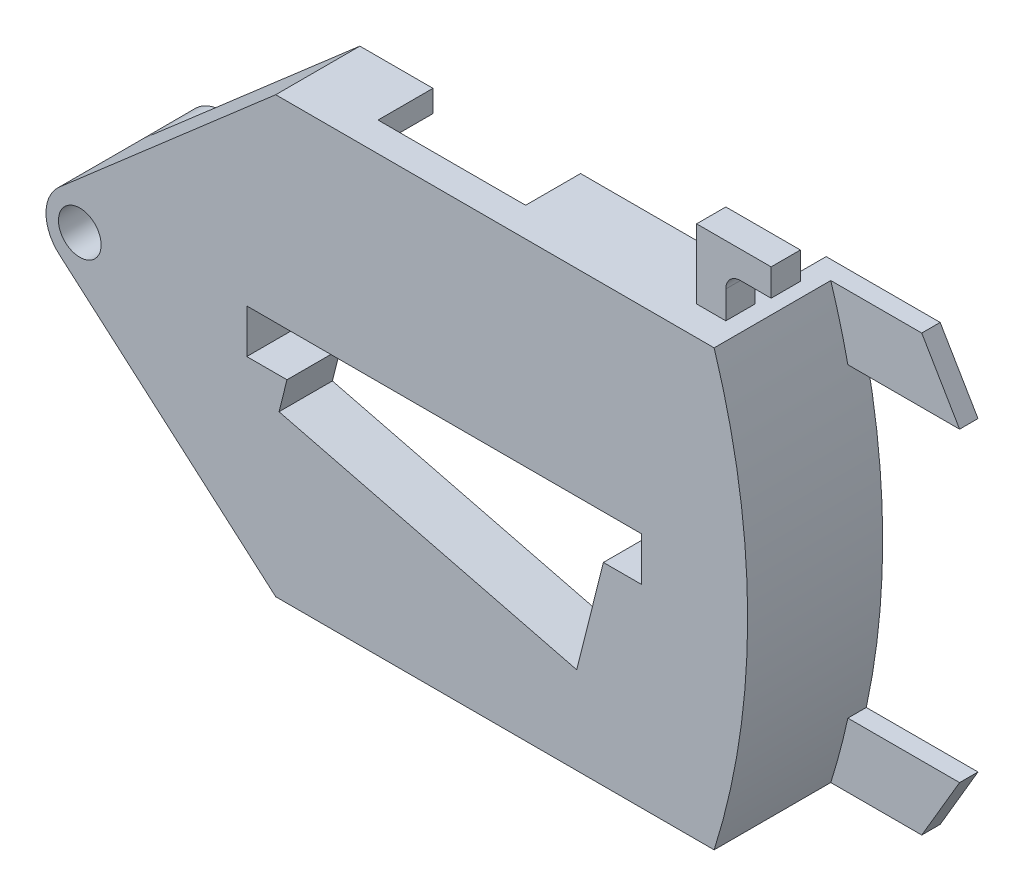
SolidWorks part; units mm, degrees
ref_plane "Plane1" through (0, 0, 0) normal (0, 0, 1) x (1, 0, 0)
ref_plane "Plane2" through (0, 0, 0) normal (0, 1, 0) x (1, 0, 0)
ref_plane "Plane3" through (0, 0, 0) normal (1, 0, 0) x (0, 0, -1)
sketch "Sketch1" plane through (0, 0, 0) normal (0, 0, 1) x (1, 0, 0)
  line L0 (-12.6668, 0) -> (55.8663, 0) construction
  line L1 (0, 0) -> (17.1073, 14.875)
  line L2 (0, 0) -> (17.1073, -14.875)
  line L3 (17.1073, 14.875) -> (47.1073, 14.875)
  line L4 (17.1073, -14.875) -> (47.1073, -14.875)
  arc A0 (47.1073, -14.875) -> (47.1073, 14.875) centre (0, 0) ccw
  dimension "D2" = 49.4
  dimension "D1" = 29.75
  dimension "D3" = 30
extrude "Base-Extrude" add sketch "Sketch1" along normal blind 5.76
sketch "Sketch2" plane through (0, 0, 5.76) normal (0, 0, 1) x (1, 0, 0)
  line L2 (0, 0) -> (17.1073, 14.875) construction
  line L3 (0, 0) -> (17.1073, -14.875) construction
  circle A0 centre (4.0387, 0) radius 2.65
  dimension "D1" = 5.3
extrude "Boss-Extrude1" add sketch "Sketch2" against normal blind 9.45
sketch "Sketch3" plane through (0, 0, 5.76) normal (0, 0, 1) x (1, 0, 0)
  line L0 (0, 0) -> (17.1073, -14.875) construction
  line L1 (0, 0) -> (17.1073, 14.875) construction
  line L2 (0, 0) -> (2.2999, -1.9998)
  line L3 (0, 0) -> (2.2999, 1.9998)
  arc A0 (2.2999, 1.9998) -> (2.2999, -1.9998) centre (4.0387, 0) ccw construction
  arc A1 (2.2999, 1.9998) -> (2.2999, -1.9998) centre (4.0387, 0) ccw
extrude "Cut-Extrude3" cut sketch "Sketch3" against normal through all
sketch "Sketch4" plane through (0, 0, -3.69) normal (0, 0, -1) x (-1, 0, 0)
  circle A0 centre (-4.0387, 0) radius 1.37
  dimension "D1" = 2.74
extrude "Boss-Extrude2" add sketch "Sketch4" along normal blind 2.64 draft 1
sketch "Sketch6" plane through (0, 0, 5.76) normal (0, 0, 1) x (1, 0, 0)
  line L0 (1.3887, 0) -> (49.4, 0) construction
  line L1 (1.3887, 0) -> (1.3887, 1.0249) construction
  arc A1 (47.1073, -14.875) -> (47.1073, 14.875) centre (0, 0) ccw construction
  arc A2 (2.2999, 1.9998) -> (2.2999, -1.9998) centre (4.0387, 0) ccw construction
  dimension "D1" = 48.0113
sketch "Sketch7" plane through (0, 0, 5.76) normal (0, 0, 1) x (1, 0, 0)
  circle A2 centre (3.7016, 0) radius 1.15
  dimension "D1" = 2.3
extrude "Cut-Extrude4" cut sketch "Sketch7" against normal offset from surface (11.09 mm away) 1
sketch "Sketch8" plane through (0, 0, 5.76) normal (0, 0, 1) x (1, 0, 0)
  line L0 (-0.719, 1.37) -> (50.999, 1.37) construction
  line L1 (15.1282, 1.37) -> (42.1282, 1.37)
  line L2 (42.1282, 1.37) -> (42.1282, -1.63)
  line L3 (42.1282, -1.63) -> (39.5282, -1.63)
  line L4 (39.5282, -1.63) -> (37.7042, -8.9048)
  line L5 (37.7042, -8.9048) -> (17.3347, -3.7977)
  line L6 (17.3347, -3.7977) -> (17.8782, -1.63)
  line L7 (17.8782, -1.63) -> (15.1282, -1.63)
  line L8 (15.1282, -1.63) -> (15.1282, 1.37)
  circle A0 centre (4.0387, 0) radius 1.37 construction
  dimension "D1" = 27
  dimension "D2" = 21
  dimension "D3" = 3
  dimension "D4" = 3
  dimension "D5" = 7.5
  dimension "D6" = 2.6
  dimension "D7" = 2.75
  dimension "D8" = 2.2348
extrude "Cut-Extrude5" cut sketch "Sketch8" against normal through all
sketch "Sketch9" plane through (0, 0, 0) normal (0, 0, -1) x (-1, 0, 0)
  line L12 (-3.2841, 0.8678) -> (-17.6682, 13.375)
  line L13 (-17.6682, 13.375) -> (-45.9948, 13.375)
  line L14 (-17.6682, -13.375) -> (-45.9948, -13.375)
  line L15 (-3.2841, -0.8678) -> (-17.6682, -13.375)
  line L16 (-5.0857, 2.4344) -> (-17.6682, 13.375)
  line L17 (-17.6682, 13.375) -> (-45.9948, 13.375)
  line L18 (-17.6682, -13.375) -> (-45.9948, -13.375)
  line L19 (-5.0857, -2.4344) -> (-17.6682, -13.375)
  circle A4 centre (-4.0387, 0) radius 2.65 construction
  arc A5 (-45.9948, 13.375) -> (-45.9948, -13.375) centre (0, 0) ccw
  arc A6 (-45.9948, 13.375) -> (-45.9948, -13.375) centre (0, 0) ccw
  arc A7 (-5.0857, 2.4344) -> (-5.0857, -2.4344) centre (-4.0387, 0) ccw
  dimension "D1" = 1.5
extrude "Cut-Extrude6" cut sketch "Sketch9" against normal offset from surface (3.76 mm away) 2
sketch "Sketch10" plane through (0, 0, 3.76) normal (0, 0, -1) x (-1, 0, 0)
  line L0 (-15.1282, 1.37) -> (-15.1282, -1.63) construction
  line L1 (-15.1282, -1.63) -> (-17.8782, -1.63) construction
  line L2 (-17.8782, -1.63) -> (-17.3347, -3.7977) construction
  line L3 (-17.3347, -3.7977) -> (-37.7042, -8.9048) construction
  line L4 (-37.7042, -8.9048) -> (-39.5282, -1.63) construction
  line L5 (-39.5282, -1.63) -> (-42.1282, -1.63) construction
  line L6 (-42.1282, -1.63) -> (-42.1282, 1.37) construction
  line L7 (-42.1282, 1.37) -> (-15.1282, 1.37) construction
  line L8 (-43.1282, -2.63) -> (-43.1282, 2.37)
  line L9 (-40.3084, -2.63) -> (-43.1282, -2.63)
  line L10 (-38.431, -10.118) -> (-40.3084, -2.63)
  line L11 (-16.1215, -4.5245) -> (-38.431, -10.118)
  line L12 (-16.5965, -2.63) -> (-16.1215, -4.5245)
  line L13 (-14.1282, -2.63) -> (-16.5965, -2.63)
  line L14 (-14.1282, 2.37) -> (-14.1282, -2.63)
  line L15 (-43.1282, 2.37) -> (-14.1282, 2.37)
  line L16 (-43.1282, -2.63) -> (-43.1282, 2.37)
  line L17 (-40.3084, -2.63) -> (-43.1282, -2.63)
  line L18 (-38.431, -10.118) -> (-40.3084, -2.63)
  line L19 (-16.1215, -4.5245) -> (-38.431, -10.118)
  line L20 (-16.5965, -2.63) -> (-16.1215, -4.5245)
  line L21 (-14.1282, -2.63) -> (-16.5965, -2.63)
  line L22 (-14.1282, 2.37) -> (-14.1282, -2.63)
  line L23 (-43.1282, 2.37) -> (-14.1282, 2.37)
  line L24 (-15.1282, 1.37) -> (-15.1282, -1.63)
  line L25 (-15.1282, -1.63) -> (-17.8782, -1.63)
  line L26 (-17.8782, -1.63) -> (-17.3347, -3.7977)
  line L27 (-17.3347, -3.7977) -> (-37.7042, -8.9048)
  line L28 (-37.7042, -8.9048) -> (-39.5282, -1.63)
  line L29 (-39.5282, -1.63) -> (-42.1282, -1.63)
  line L30 (-42.1282, -1.63) -> (-42.1282, 1.37)
  line L31 (-42.1282, 1.37) -> (-15.1282, 1.37)
  dimension "D1" = 1
extrude "Boss-Extrude3" add sketch "Sketch10" along normal blind 1.65
sketch "Sketch11" plane through (0, 14.875, 0) normal (0, 1, 0) x (-1, 0, 0)
  line L0 (-32.2073, 0) -> (-22.1073, 0)
  line L1 (-32.2073, 0) -> (-32.2073, 3.76)
  line L2 (-22.1073, 3.76) -> (-32.2073, 3.76)
  line L3 (-22.1073, 3.76) -> (-22.1073, 0)
  line L4 (-17.1073, 0) -> (-47.1073, 0) construction
  line L5 (-17.1073, 5.76) -> (-17.1073, 0) construction
  line L6 (-17.6682, 3.76) -> (-45.9948, 3.76) construction
  dimension "D1" = 5
  dimension "D2" = 10.1
extrude "Cut-Extrude7" cut sketch "Sketch11" against normal up to surface (1.5 mm away)
sketch "Sketch12" plane through (0, -14.875, 0) normal (0, -1, 0) x (1, 0, 0)
  line L0 (22.1073, 0) -> (22.1073, 3.76) construction
  line L1 (32.2073, 3.76) -> (32.2073, 0) construction
  line L2 (22.1073, 0) -> (22.1073, 1.65)
  line L3 (32.2073, 1.65) -> (32.2073, 0)
  line L4 (32.2073, 1.65) -> (22.1073, 1.65)
  line L5 (32.2073, 0) -> (22.1073, 0)
  dimension "D1" = 1.65
extrude "Cut-Extrude8" cut sketch "Sketch12" against normal up to surface (1.5 mm away)
sketch "Sketch13" plane through (0, 0, 3.76) normal (0, 0, -1) x (-1, 0, 0)
  line L4 (-17.6682, -13.375) -> (-17.6682, -9.095) construction
  line L5 (-18.3782, -13.375) -> (-18.3782, -9.095)
  line L6 (-17.6682, -13.375) -> (-22.1073, -13.375) construction
  line L7 (-18.3782, -9.095) -> (-16.9582, -9.095)
  line L8 (-16.9582, -9.095) -> (-16.9582, -12.7576)
  line L9 (-5.0857, -2.4344) -> (-17.6682, -13.375) construction
  line L10 (-16.9582, -12.7576) -> (-17.6682, -13.375)
  line L11 (-17.6682, -13.375) -> (-18.3782, -13.375)
  dimension "D1" = 1.42
  dimension "D2" = 4.28
extrude "Boss-Extrude4" add sketch "Sketch13" along normal up to surface (3.76 mm away)
fillet "Fillet1" radius 0.7 2 edges at (16.9582, -9.095, 1.88) (18.3782, -9.095, 1.88)
sketch "Sketch14" plane through (0, 0, 0) normal (0, 0, -1) x (-1, 0, 0)
  line L1 (-38.431, -10.118) -> (-38.431, -18.0474) construction
  line L2 (-38.431, -10.675) -> (-39.801, -10.675)
  line L3 (-39.801, -10.675) -> (-39.801, -13.375)
  line L4 (-32.2073, -13.375) -> (-45.9948, -13.375) construction
  line L5 (-39.801, -13.375) -> (-45.9948, -13.375)
  line L6 (-45.9948, -13.375) -> (-47.1073, -14.875)
  line L7 (-47.1073, -14.875) -> (-38.431, -14.875)
  line L8 (-38.431, -14.875) -> (-38.431, -10.675)
  dimension "D1" = 4.2
  dimension "D2" = 1.37
extrude "Boss-Extrude5" add sketch "Sketch14" along normal blind 1.42 and the other way up to surface
fillet "Fillet5" radius 0.685 4 edges at (38.431, -10.675, 1.17) (39.116, -10.675, 3.76) (39.801, -10.675, 1.17) (39.116, -10.675, -1.42)
sketch "Sketch15" plane through (0, 0, 0) normal (0, 0, -1) x (-1, 0, 0)
  line L2 (-47.1073, 14.875) -> (-45.5318, 14.875)
  line L4 (-47.1073, -14.875) -> (-45.5318, -14.875)
  arc A0 (-45.9948, 13.375) -> (-45.9948, -13.375) centre (0, 0) ccw construction
  arc A1 (-47.1073, 14.875) -> (-47.1073, -14.875) centre (0, 0) ccw construction
  arc A2 (-45.5318, 14.875) -> (-45.5318, -14.875) centre (0, 0) ccw
  arc A3 (-47.1073, 14.875) -> (-47.1073, -14.875) centre (0, 0) ccw
extrude "Boss-Extrude6" add sketch "Sketch15" along normal blind 3.48
sketch "Sketch16" plane through (0, 0, -3.48) normal (0, 0, -1) x (-1, 0, 0)
  line L0 (-47.1073, -14.875) -> (-45.5318, -14.875) construction
  line L1 (-47.1073, 14.875) -> (-45.5318, 14.875) construction
  line L2 (-47.1073, -14.875) -> (-45.5318, -14.875)
  line L3 (-47.1073, 14.875) -> (-45.5318, 14.875)
  line L4 (0, 0) -> (-58.7476, 0) construction
  line L5 (-47.1073, 14.875) -> (-53.3318, 14.875)
  line L6 (-47.1073, -14.875) -> (-53.3318, -14.875)
  line L7 (-53.3318, 14.875) -> (-55.9216, 10.4705)
  line L8 (-53.3318, -14.875) -> (-55.9216, -10.4705)
  line L9 (-55.9216, 10.4705) -> (-46.7416, 10.4705)
  line L10 (-55.9216, -10.4705) -> (-46.7416, -10.4705)
  arc A0 (-45.5318, 14.875) -> (-45.5318, -14.875) centre (0, 0) ccw construction
  arc A1 (-45.5318, 14.875) -> (-46.7416, 10.4705) centre (0, 0) ccw
  arc A3 (-46.7416, -10.4705) -> (-45.5318, -14.875) centre (0, 0) ccw
  dimension "D1" = 7.8
  dimension "D2" = 9.18
extrude "Boss-Extrude7" add sketch "Sketch16" against normal blind 1.26
sketch "Sketch17" plane through (0, 0, 5.76) normal (0, 0, 1) x (1, 0, 0)
  line L0 (45.9073, 14.875) -> (45.9073, 17.765)
  line L1 (17.1073, 14.875) -> (47.1073, 14.875) construction
  line L2 (45.9073, 17.765) -> (49.0073, 17.765)
  line L3 (49.0073, 17.765) -> (49.0073, 19.625)
  line L4 (49.0073, 19.625) -> (43.9073, 19.625)
  line L5 (43.9073, 19.625) -> (43.9073, 14.875)
  line L6 (43.9073, 14.875) -> (45.9073, 14.875)
  dimension "D1" = 5.1
  dimension "D2" = 1.86
  dimension "D3" = 4.75
  dimension "D4" = 2
  dimension "D5" = 1.2
extrude "Boss-Extrude8" add sketch "Sketch17" against normal blind 4
sketch "Sketch18" plane through (43.9073, 0, 0) normal (-1, 0, 0) x (0, 0, 1)
  line L0 (3.76, 19.625) -> (3.76, 13.375) construction
  line L1 (3.76, 19.625) -> (3.76, 14.875)
  line L4 (5.76, 14.875) -> (5.76, 19.625)
  line L5 (5.76, 19.625) -> (1.76, 19.625)
  line L6 (1.76, 19.625) -> (1.76, 14.875)
  line L7 (1.76, 14.875) -> (5.76, 14.875)
  line L8 (5.76, 14.875) -> (5.76, 19.625)
  line L9 (5.76, 19.625) -> (3.76, 19.625)
  line L11 (3.76, 14.875) -> (5.76, 14.875)
  dimension "D1" = 0
extrude "Cut-Extrude9" cut sketch "Sketch18" against normal through all
fillet "Fillet2" radius 1 1 edges at (45.9073, 17.765, 2.76)
sketch "Sketch21" plane through (0, 0, 1.18) normal (0, 0, -1) x (-1, 0, 0)
  circle A0 centre (-3.7016, 0) radius 1.46 construction
  circle A1 centre (-3.7016, 0) radius 1.46
extrude "Cut-Extrude13" cut sketch "Sketch21" against normal up to surface (6.58 mm away)
